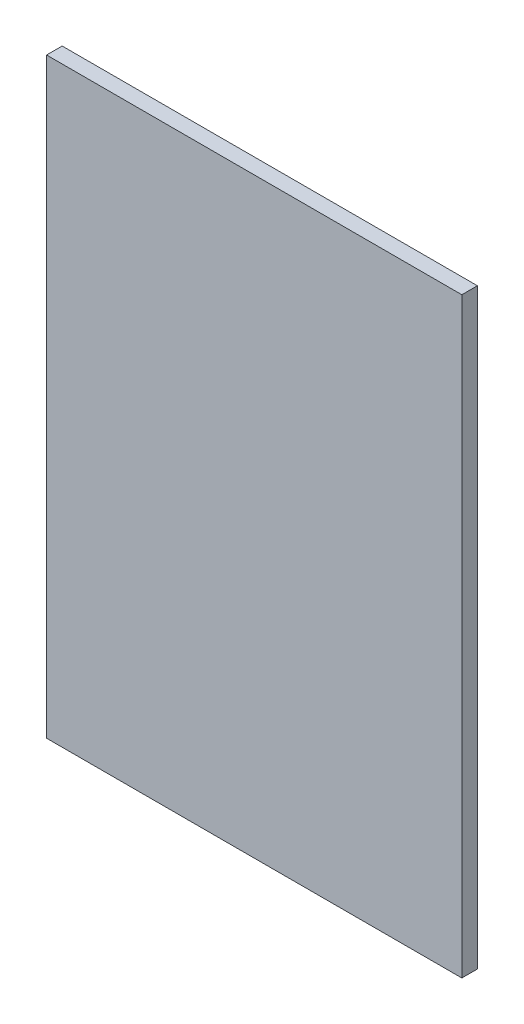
SolidWorks part; units mm, degrees
ref_plane "Alzado" through (0, 0, 0) normal (0, 0, 1) x (1, 0, 0)
ref_plane "Planta" through (0, 0, 0) normal (0, 1, 0) x (1, 0, 0)
ref_plane "Vista lateral" through (0, 0, 0) normal (1, 0, 0) x (0, 0, -1)
sketch "Croquis1" plane through (0, 0, 0) normal (0, 0, 1) x (1, 0, 0)
  line L1 (-200, 285) -> (200, 285)
  line L2 (-200, 285) -> (-200, -285)
  line L3 (-200, -285) -> (200, -285)
  line L4 (200, 285) -> (200, -285)
  line L5 (-200, 285) -> (200, -285) construction
  line L6 (-200, -285) -> (200, 285) construction
  point P0 (0, 0)
  dimension "D1" = 400
  dimension "D2" = 570
extrude "Saliente-Extruir1" add sketch "Croquis1" along normal blind 15
